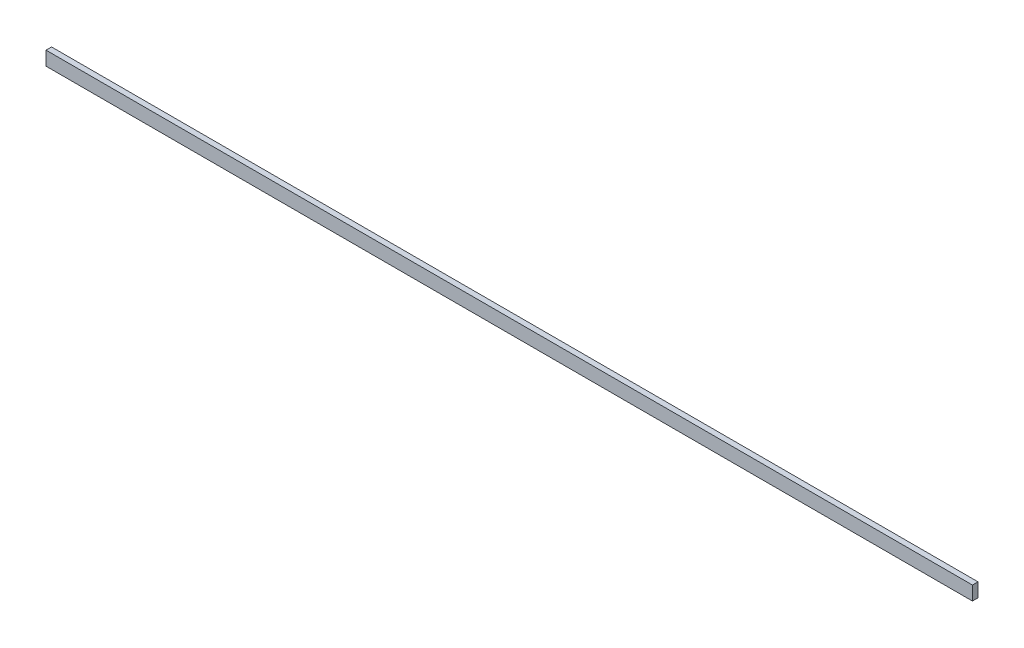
SolidWorks part; units mm, degrees
ref_plane "Front Plane" through (0, 0, 0) normal (0, 0, 1) x (1, 0, 0)
ref_plane "Top Plane" through (0, 0, 0) normal (0, 1, 0) x (1, 0, 0)
ref_plane "Right Plane" through (0, 0, 0) normal (1, 0, 0) x (0, 0, -1)
sketch "Sketch1" plane through (0, 0, 0) normal (0, 0, 1) x (1, 0, 0)
  line L1 (0, 0) -> (2000, 0)
  line L2 (0, 0) -> (0, -30)
  line L3 (0, -30) -> (2000, -30)
  line L4 (2000, 0) -> (2000, -30)
  dimension "D1" = 2000
  dimension "D2" = 30
extrude "Boss-Extrude1" add sketch "Sketch1" along normal blind 12
